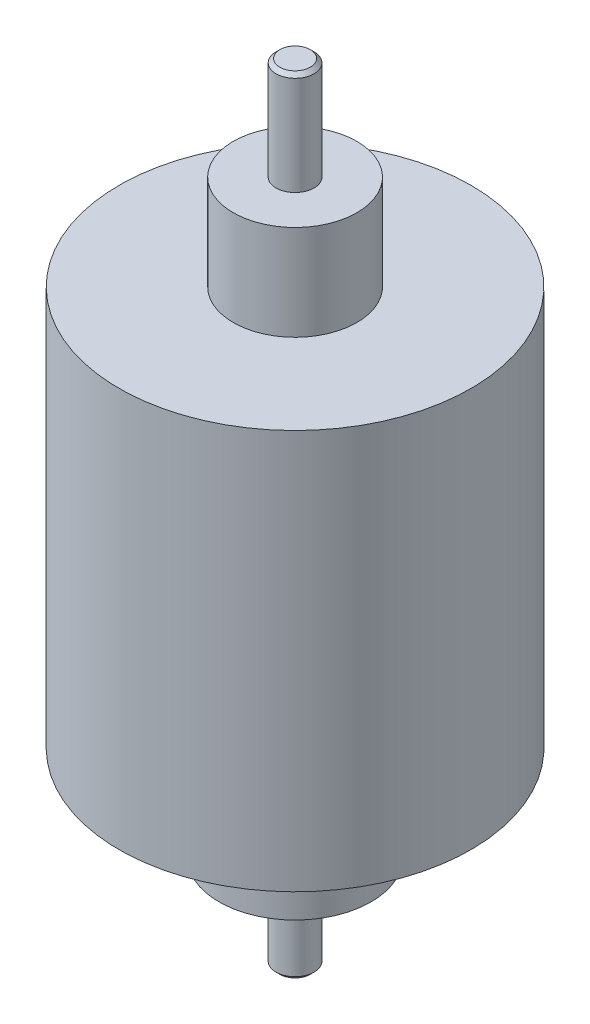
SolidWorks part; units mm, degrees
other "<ALD_M840029__P_Portescap_22NT_82_213P>-<Extrusion26>"
ref_plane "Dessus" through (0, 0, 0) normal (0, 0, 1) x (1, 0, 0)
ref_plane "Droite" through (0, 0, 0) normal (0, 1, 0) x (1, 0, 0)
ref_plane "Face" through (0, 0, 0) normal (1, 0, 0) x (0, 0, -1)
imported_body "Importée2"
sketch "Esquisse1" plane through (0, 0, 0) normal (1, 0, 0) x (0, 0, -1)
  line L0 (-1, 35.3994) -> (-1, 29.9994)
  line L1 (-1, 29.9994) -> (-3.25, 29.9994)
  line L2 (-3.25, 29.9994) -> (-3.25, 24.9994)
  line L3 (-3.25, 24.9994) -> (-9.25, 24.9994)
  line L4 (-9.25, 24.9994) -> (-9.25, 3.9994)
  line L5 (-9.25, 3.9994) -> (-4, 3.9994)
  line L6 (-4, 3.9994) -> (-4, -1.0006)
  line L7 (-4, -1.0006) -> (-1, -1.0006)
  line L8 (-1, -1.0006) -> (-1, -21.0006)
  line L9 (-1, -21.0006) -> (-22.5, -21.0006)
  line L10 (-22.5, -21.0006) -> (-22.5, 49.9994)
  line L11 (0, 49.9994) -> (-22.5, 49.9994)
  line L12 (0, 0) -> (0, 49.0143) construction
  line L14 (11, 29.5) -> (-11, 29.5) construction
  line L16 (-1, 35.3994) -> (0, 35.3994)
  line L17 (0, 35.3994) -> (0, 49.9994)
  dimension "D2" = 2
  dimension "D3" = 8
  dimension "D4" = 6.5
  dimension "D5" = 18.5
  dimension "D6" = 4.5006
  dimension "D7" = 21
  dimension "D8" = 5
  dimension "D9" = 2
  dimension "D10" = 45
  dimension "D11" = 25
  dimension "D12" = 20
  dimension "D13" = 5
  dimension "D14" = 5.4
revolve "Enlèvement de matière-Révolution5" cut sketch "Esquisse1" angle 360 about L12
